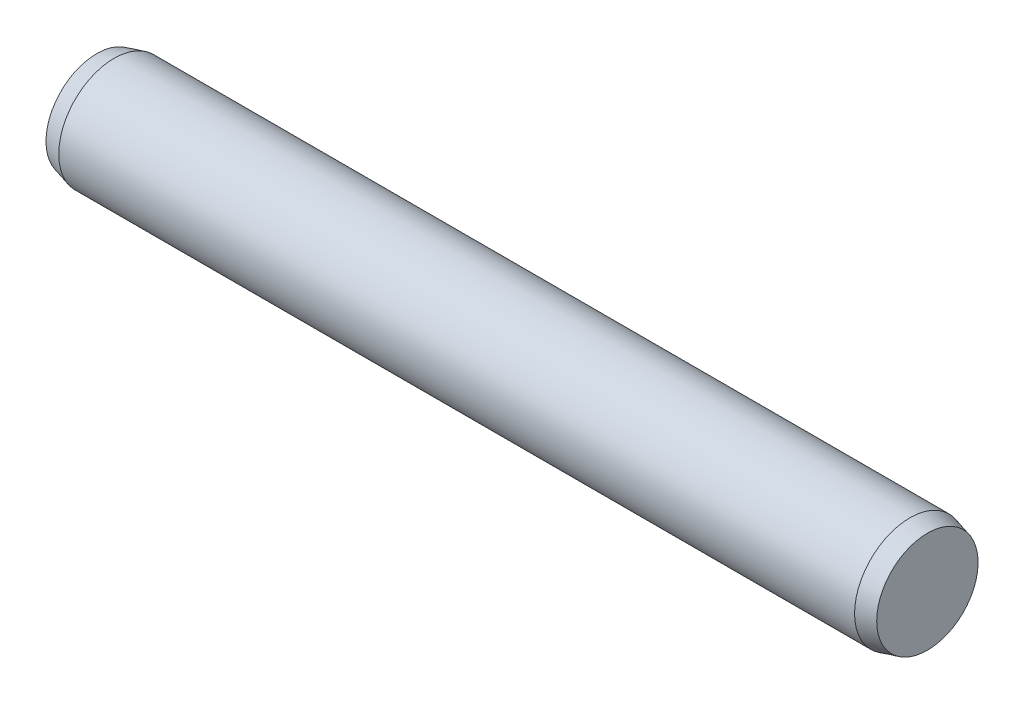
SolidWorks part; units mm, degrees
ref_plane "Plane1" through (0, 0, 0) normal (0, 0, 1) x (1, 0, 0)
ref_plane "Plane2" through (0, 0, 0) normal (0, 1, 0) x (1, 0, 0)
ref_plane "Plane3" through (0, 0, 0) normal (1, 0, 0) x (0, 0, -1)
revolve "Base-Revolve" add sketch "Sketch1" angle 360 about L1
sketch "Sketch1" plane through (0, 0, 0) normal (0, 0, 1) x (1, 0, 0)
  line L1 (-6.35, 0) -> (107.95, 0) construction
  line L2 (0, 0) -> (30, 0)
  line L3 (30, 0) -> (30, 1.8312)
  line L4 (30, 1.8312) -> (29.37, 2)
  line L5 (29.37, 2) -> (0.63, 2)
  line L6 (0, 1.8312) -> (0, 0)
  line L7 (0, 1.8312) -> (0.63, 2)
  dimension "D1" = 0.63
  dimension "D2" = 15
  dimension "D3" = 15
  dimension "Diameter" = 4
  dimension "Length" = 30
  dimension "Chamfer_len" = 0.63
equation "\"D3@Sketch1\" = 15.0"
equation "\"D1@Sketch1\" = \"Chamfer_len@Sketch1\""
equation "\"D2@Sketch1\" = \"D3@Sketch1\""
